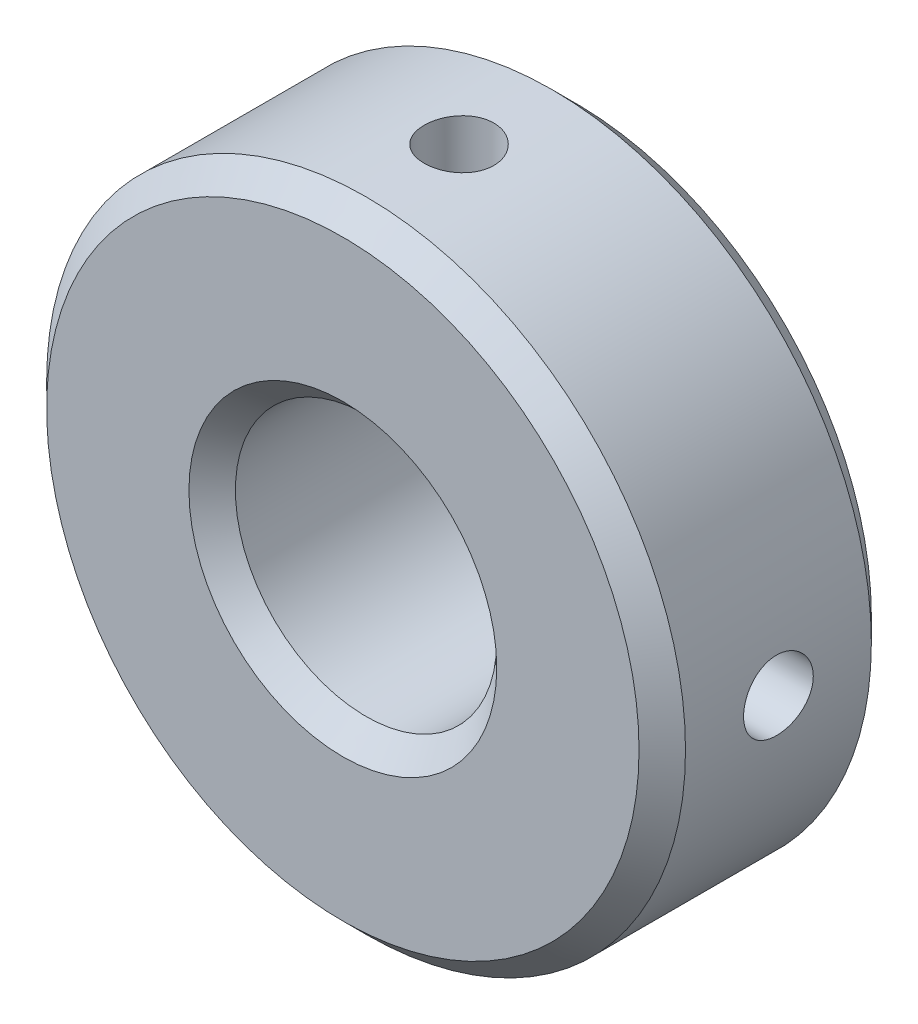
SolidWorks part; units mm, degrees
ref_plane "Front" through (0, 0, 0) normal (0, 0, 1) x (1, 0, 0)
ref_plane "Top" through (0, 0, 0) normal (0, 1, 0) x (1, 0, 0)
ref_plane "Right" through (0, 0, 0) normal (1, 0, 0) x (0, 0, -1)
other "Configuration Table"
sketch "Sketch1" plane through (0, 0, 0) normal (0, 0, 1) x (1, 0, 0)
  circle A0 centre (0, 0) radius 11
  circle A1 centre (0, 0) radius 4.5
extrude "BaseNut" add sketch "Sketch1" against normal mid plane 8
ref_plane "Plane1" through (0, 11, 0) normal (0, 1, 0) x (-1, 0, 0)
sketch "Sketch2" plane through (0, 0, 0) normal (0, 0, 1) x (1, 0, 0)
  line L0 (0, 14.609) -> (0, -14.0536) construction
  line L2 (0, 11) -> (1.2001, 11)
  line L5 (1.2001, 11) -> (1.2001, 7.6105)
  line L6 (0, 6.9177) -> (1.2001, 7.6105)
  line L7 (0, 11) -> (0, 6.9177)
  circle A1 centre (0, 0) radius 11 construction
  dimension "t" = 3.3895
  dimension "d1" = 2.4002
  dimension "D2" = 60
revolve "Cut-Revolve2" cut sketch "Sketch2" angle 360 about L0
pattern_circular "CirPattern1" count 4 over 360 about axis through (0, 0, -4) along (0, 0, 1) of "Cut-Revolve2"
chamfer "Chamfer1" distance 0.8 angle 45 4 edges at (4.5, 0, -4) (11, 0, -4) (4.5, 0, 4) (11, 0, 4)
sketch "Sketch3" plane through (0, 0, 0) normal (0, 1, 0) x (1, 0, 0)
  line L0 (0, 7.0838) -> (0, -7.8506) construction
  line L1 (4, 3.45) -> (4.5, 3.45)
  line L2 (4.5, 3.45) -> (4.933, 3.2)
  line L3 (4.933, 3.2) -> (4.5, 2.95)
  line L4 (4.5, 2.95) -> (4, 2.95)
  line L5 (4, 2.95) -> (4, 3.45)
  line L6 (4.5, 3.2) -> (-4.5, 3.2) construction
revolve "Cut-Revolve10" [suppressed] cut sketch "Sketch3" angle 360 about L0
pattern_linear "LPattern10" [suppressed] count 13 spacing 0.6 along (0, 0, 1)
equation "\"D2@Sketch3\" = \"D2@Sketch1\""
equation "\"D1@Sketch3\" = (  \"D2@ThreadCosmetic1\" - \"D2@Sketch1\" )  / 2"
equation "\"D3@LPattern10\" = \"D1@Sketch3\" * 1.2"
equation "\"D1@LPattern10\" = \"m@BaseNut\" / \"D3@LPattern10\""
